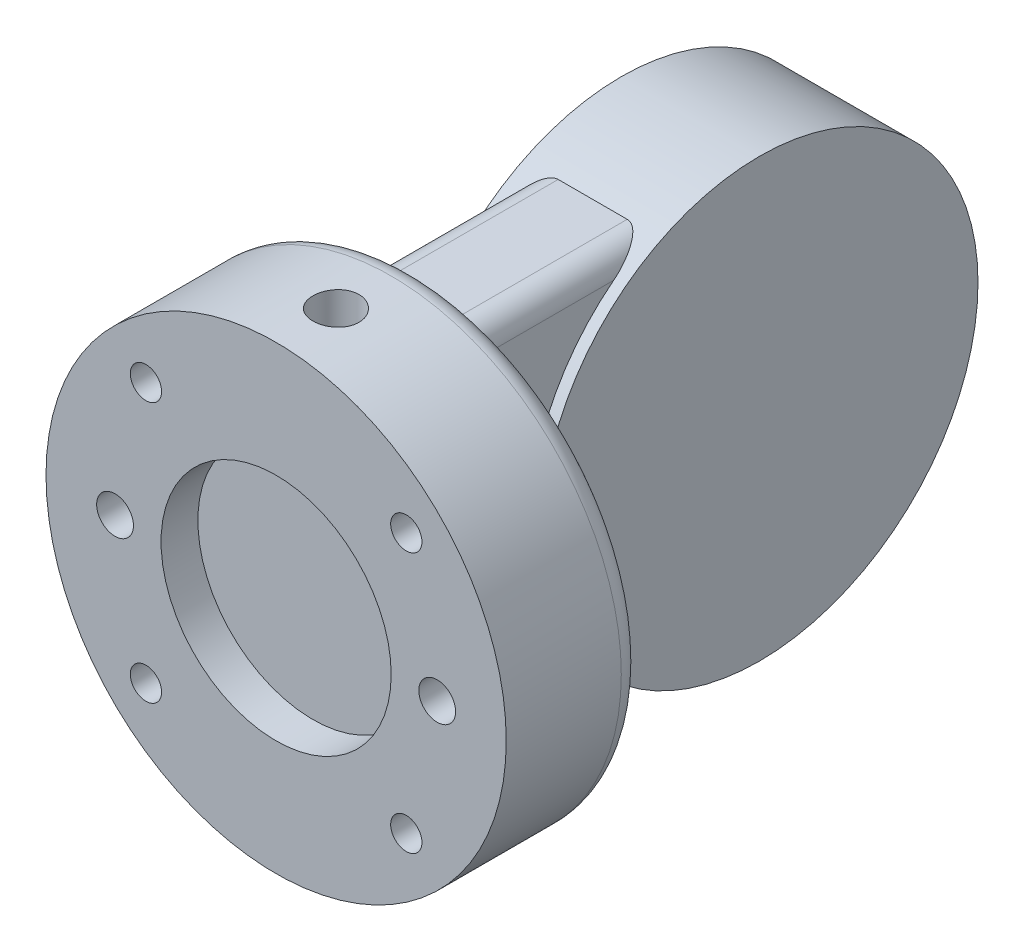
SolidWorks part; units mm, degrees
ref_plane "正面" through (0, 0, 0) normal (0, 0, 1) x (1, 0, 0)
ref_plane "平面" through (0, 0, 0) normal (0, 1, 0) x (1, 0, 0)
ref_plane "右側面" through (0, 0, 0) normal (1, 0, 0) x (0, 0, -1)
sketch "ｽｹｯﾁ1" plane through (0, 0, 0) normal (1, 0, 0) x (0, 0, -1)
  circle A0 centre (0, 0) radius 47.5
  dimension "D1" = 95
extrude "ﾎﾞｽ - 押し出し1" add sketch "ｽｹｯﾁ1" along normal mid plane 30
sketch "ｽｹｯﾁ2" plane through (0, 0, 0) normal (1, 0, 0) x (0, 0, -1)
  line L1 (-90, 42.5) -> (0, 42.5)
  line L2 (-90, 42.5) -> (-90, -42.5)
  line L3 (-90, -42.5) -> (0, -42.5)
  line L4 (0, 42.5) -> (0, -42.5)
  dimension "D1" = 85
  dimension "D2" = 90
extrude "ﾎﾞｽ - 押し出し2" add sketch "ｽｹｯﾁ2" along normal mid plane 25
sketch "ｽｹｯﾁ3" plane through (0, 0, 90) normal (0, 0, 1) x (1, 0, 0)
  circle A0 centre (0, 0) radius 50
  dimension "D1" = 100
extrude "ﾎﾞｽ - 押し出し3" add sketch "ｽｹｯﾁ3" against normal blind 30
sketch "ｽｹｯﾁ4" plane through (0, 0, 90) normal (0, 0, 1) x (1, 0, 0)
  circle A0 centre (0, 0) radius 25
  dimension "D1" = 50
extrude "ｶｯﾄ - 押し出し1" cut sketch "ｽｹｯﾁ4" against normal blind 8
sketch "ｽｹｯﾁ5" plane through (0, 0, 90) normal (0, 0, 1) x (1, 0, 0)
  line L0 (-35, 0) -> (35, 0) construction
  circle A0 centre (35, 0) radius 4
  circle A1 centre (-35, 0) radius 4
  point P4 (0, 0)
  dimension "D2" = 8
  dimension "D1" = 70
extrude "ｶｯﾄ - 押し出し2" cut sketch "ｽｹｯﾁ5" against normal blind 15
hole_wizard "M8x1.25 ねじ穴1" positions "ｽｹｯﾁ6" profile "ｽｹｯﾁ8" tap size "M8x1.25" standard "JIS"
sketch "ｽｹｯﾁ6" plane through (0, 0, 90) normal (0, 0, 1) x (1, 0, 0)
  line L0 (-28.2843, 28.2843) -> (0, 0)
  line L1 (0, 0) -> (-40, 0)
  circle A0 centre (0, 0) radius 40
  point P0 (-28.2843, 28.2843)
  dimension "D1" = 80
  dimension "D2" = 45
sketch "ｽｹｯﾁ8" plane through (-28.2843, 28.2843, 90) normal (1, 0, 0) x (0, -1, 0)
  line L0 (0, 0) -> (0, 26.0429)
  line L1 (0, 26.0429) -> (3.4, 24)
  line L2 (3.4, 24) -> (3.4, 0)
  line L5 (3.4, 0) -> (0, 0)
  line L10 (0, 26.0429) -> (-3.4, 24) construction
  line L11 (0, -6.35) -> (0, 107.95) construction
  dimension "ねじ下穴ﾄﾞﾘﾙ直径" = 6.8
  dimension "ねじ下穴ﾄﾞﾘﾙの深さ" = 24
  dimension "ﾄﾞﾘﾙ角度" = 118
pattern_circular "円形ﾊﾟﾀｰﾝ1" count 4 over 360 about axis through (0, 0, 0) along (0, 0, 1) of "M8x1.25 ねじ穴1"
ref_plane "平面1" through (0, 50, 0) normal (0, 1, 0) x (1, 0, 0)
hole_wizard "Ø10.0 (10) 直径の穴1" positions "ｽｹｯﾁ13" profile "ｽｹｯﾁ14" hole size "Ø10.0" standard "JIS"
sketch "ｽｹｯﾁ13" plane through (0, 50, 0) normal (0, 1, 0) x (1, 0, 0)
  line L0 (-50, -90) -> (50, -90) construction
  point P0 (0, -77)
  dimension "D1" = 13
sketch "ｽｹｯﾁ14" plane through (0, 50, 77) normal (1, 0, 0) x (0, 0, 1)
  line L0 (0, 0) -> (0, 23.0043)
  line L1 (0, 23.0043) -> (5, 20)
  line L2 (5, 20) -> (5, 0)
  line L5 (5, 0) -> (0, 0)
  line L10 (0, 23.0043) -> (-5, 20) construction
  line L11 (0, -6.35) -> (0, 107.95) construction
  dimension "穴の直径" = 10
  dimension "穴の深さ" = 20
  dimension "ﾄﾞﾘﾙ角度" = 118
fillet "ﾌｨﾚｯﾄ1" radius 5 5 edges at (-12.5, -42.5, 40.6066) (12.5, -42.5, 40.6066) (-12.5, 42.5, 40.6066) (12.5, 42.5, 40.6066) (50, 0, 60)
